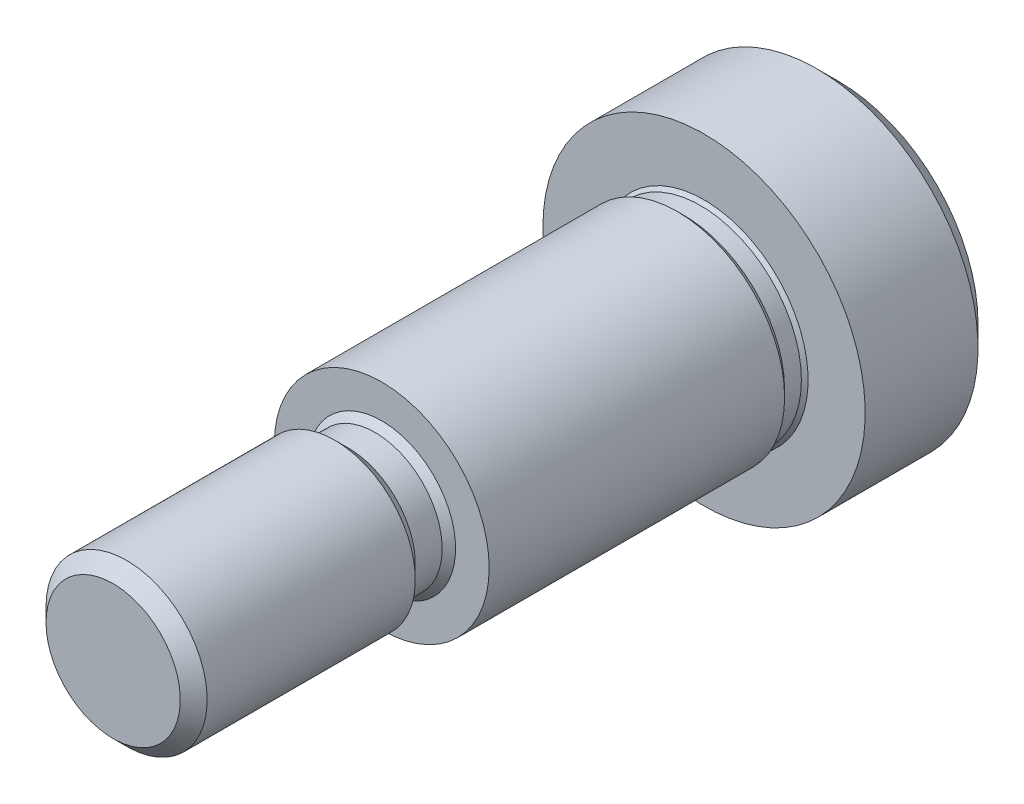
SolidWorks part; units mm, degrees
ref_plane "Front" through (0, 0, 0) normal (0, 0, 1) x (1, 0, 0)
ref_plane "Top" through (0, 0, 0) normal (0, 1, 0) x (1, 0, 0)
ref_plane "Right" through (0, 0, 0) normal (1, 0, 0) x (0, 0, -1)
sketch "Logo3_Revol_Axis" plane through (0, 0, 0) normal (0, 1, 0) x (1, 0, 0)
  line L0 (0, -25.3777) -> (0, 25.3777) construction
sketch "Logo3_bib1" plane through (0, 0, 0) normal (0, -1, 0) x (-1, 0, 0)
  line L0 (0, 62.3527) -> (0, -65.5595) construction
  line L1 (6.35, 0) -> (4.3656, 0)
  line L2 (6.35, 0) -> (6.35, 17.4625)
  line L3 (6.35, 17.4625) -> (5.9531, 17.8594)
  line L4 (9.525, 25.7175) -> (8.255, 26.9875)
  line L5 (6.1516, 19.05) -> (9.525, 19.05)
  line L6 (9.525, 19.05) -> (9.525, 25.7175)
  line L7 (8.255, 26.9875) -> (0, 26.9875)
  line L8 (5.9531, 17.8594) -> (5.9531, 18.8516)
  line L9 (4.7625, -2.7781) -> (4.7625, -15.0812)
  line L11 (4.7625, -15.0812) -> (3.9688, -15.875)
  line L12 (3.9688, -15.875) -> (0, -15.875)
  line L13 (0, -15.875) -> (0, 26.9875)
  line L14 (3.9688, -0.3969) -> (3.9688, -1.9844)
  line L15 (3.9688, -1.9844) -> (4.7625, -2.7781)
  line L16 (5.9531, 18.8516) -> (6.1516, 19.05)
  line L17 (3.9688, -0.3969) -> (4.3656, 0)
  point P18 (9.525, 26.9875)
revolve "Revolve1" add sketch "Logo3_bib1" angle 360 about L0
sketch "Logo3_bib2" plane through (0, 0, -26.9875) normal (0, 0, -1) x (1, 0, 0)
  line L1 (3.6662, 0) -> (1.8331, 3.175)
  line L2 (1.8331, 3.175) -> (-1.8331, 3.175)
  line L3 (-1.8331, 3.175) -> (-3.6662, 0)
  line L4 (-3.6662, 0) -> (-1.8331, -3.175)
  line L5 (-1.8331, -3.175) -> (1.8331, -3.175)
  line L6 (1.8331, -3.175) -> (3.6662, 0)
  circle A0 centre (0, 0) radius 3.175 construction
  dimension "Logo3_c1" = 6.35
extrude "Cut-Extrude1" cut sketch "Logo3_bib2" against normal blind 5.2917
equation "\"D2@Cosmetic Thread1\" = \"Logo3_dm-pas@Logo3_bib1\""
